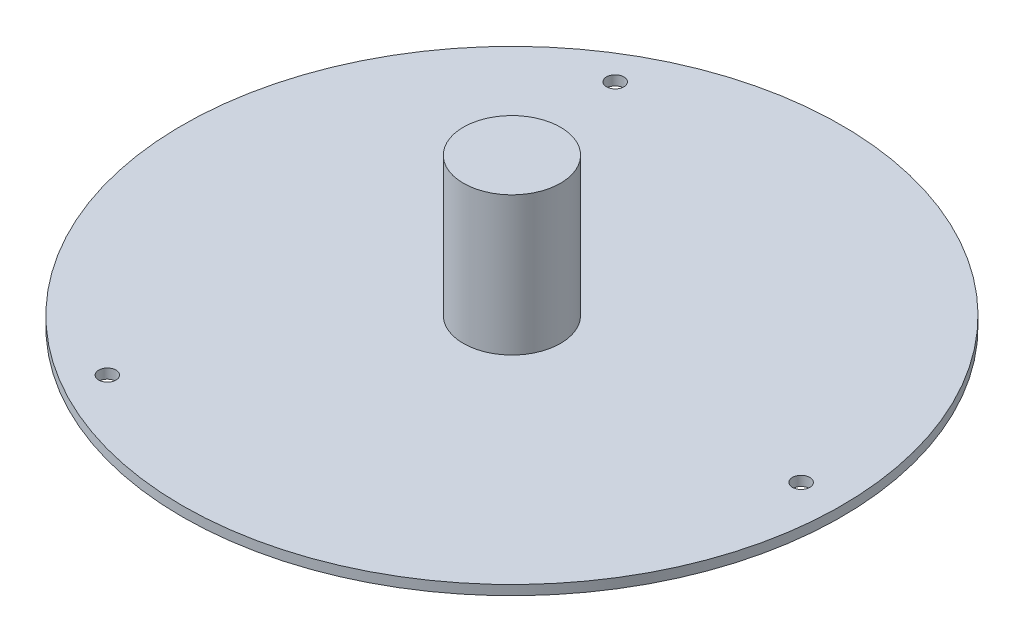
SolidWorks part; units mm, degrees
ref_plane "Front Plane" through (0, 0, 0) normal (0, 0, 1) x (1, 0, 0)
ref_plane "Top Plane" through (0, 0, 0) normal (0, 1, 0) x (1, 0, 0)
ref_plane "Right Plane" through (0, 0, 0) normal (1, 0, 0) x (0, 0, -1)
sketch "Sketch1" plane through (0, 0, 0) normal (0, 1, 0) x (1, 0, 0)
  circle A0 centre (0, 0) radius 60.325
  dimension "D1" = 120.65
extrude "Boss-Extrude1" add sketch "Sketch1" along normal blind 1.778
sketch "Sketch2" plane through (0, 1.778, 0) normal (0, 1, 0) x (1, 0, 0)
  line L0 (-27.5746, 46.482) -> (0, 0) construction
  line L1 (0, 0) -> (-27.5746, -46.482) construction
  line L2 (-27.5746, -46.482) -> (52.9345, 0) construction
  line L3 (52.9345, 0) -> (-27.5746, 46.482) construction
  line L4 (-27.5746, 46.482) -> (-27.5746, -46.482) construction
  line L5 (52.9345, 0) -> (0, 0) construction
  circle A0 centre (52.9345, 0) radius 1.5875
  circle A1 centre (-27.5746, 46.482) radius 1.5875
  circle A2 centre (-27.5746, -46.482) radius 1.5875
  dimension "D5" = 3.175
  dimension "D6" = 3.175
  dimension "D7" = 3.175
  dimension "D1" = 92.964
  dimension "D2" = 92.964
  dimension "D3" = 92.964
  dimension "D4" = 54.0457
extrude "Cut-Extrude1" cut sketch "Sketch2" against normal through all contours A1
sketch "Sketch3" plane through (0, 1.778, 0) normal (0, 1, 0) x (1, 0, 0)
  circle A0 centre (0, 0) radius 8.89
  dimension "D1" = 17.78
extrude "Boss-Extrude2" add sketch "Sketch3" along normal blind 25.4
